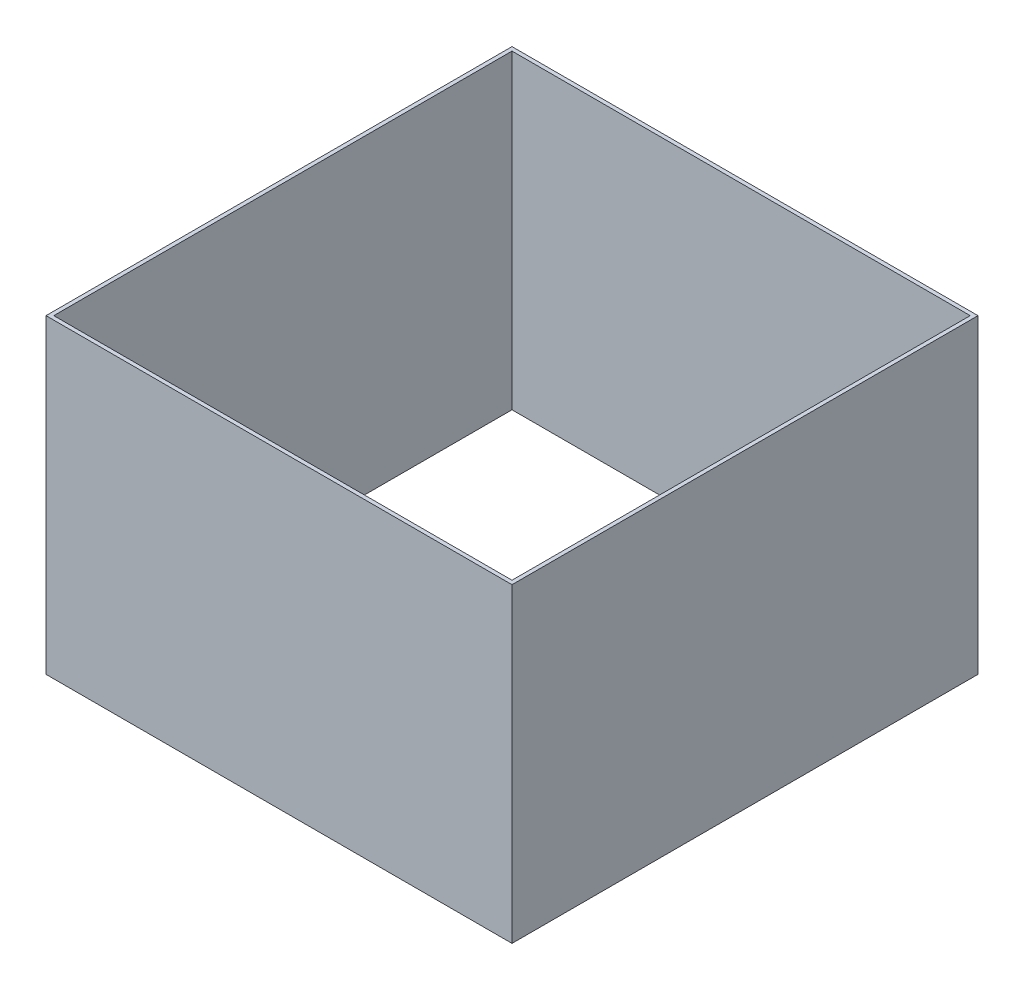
SolidWorks part; units mm, degrees
ref_plane "Front" through (0, 0, 0) normal (0, 0, 1) x (1, 0, 0)
ref_plane "Top" through (0, 0, 0) normal (0, 1, 0) x (1, 0, 0)
ref_plane "Right" through (0, 0, 0) normal (1, 0, 0) x (0, 0, -1)
sketch "Sketch1" plane through (0, 0, 0) normal (0, 1, 0) x (1, 0, 0)
  line L0 (-149.86, 149.86) -> (-149.86, -149.86)
  line L1 (152.4, 152.4) -> (-152.4, 152.4)
  line L2 (152.4, 152.4) -> (152.4, -152.4)
  line L3 (152.4, -152.4) -> (-152.4, -152.4)
  line L4 (-152.4, 152.4) -> (-152.4, -152.4)
  line L5 (152.4, 152.4) -> (-152.4, -152.4) construction
  line L6 (152.4, -152.4) -> (-152.4, 152.4) construction
  line L7 (149.86, -149.86) -> (-149.86, -149.86)
  line L8 (149.86, 149.86) -> (149.86, -149.86)
  line L9 (149.86, 149.86) -> (-149.86, 149.86)
  point P0 (0, 0)
  dimension "D1" = 304.8
  dimension "D2" = 304.8
  dimension "D3" = 2.54
extrude "Boss-Extrude1" add sketch "Sketch1" along normal blind 203.2
